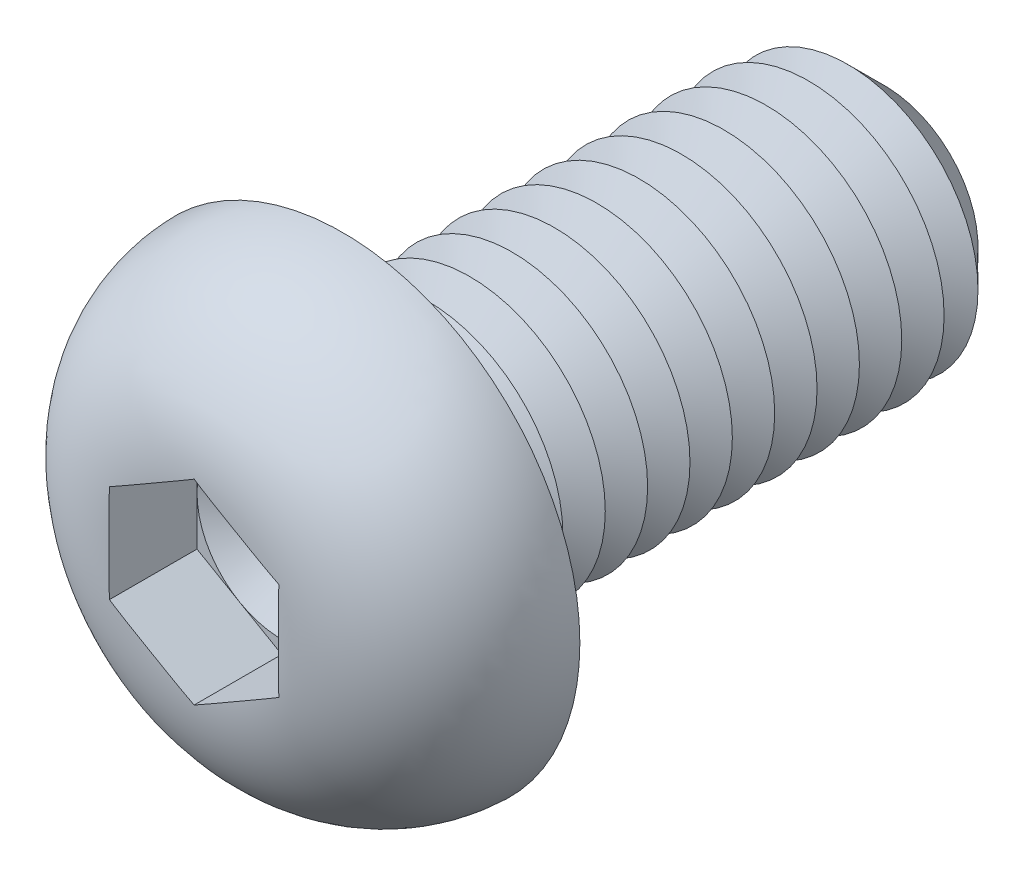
SolidWorks part; units mm, degrees
ref_plane "Front Plane" through (0, 0, 0) normal (0, 0, 1) x (1, 0, 0)
ref_plane "Top Plane" through (0, 0, 0) normal (0, 1, 0) x (1, 0, 0)
ref_plane "Right Plane" through (0, 0, 0) normal (1, 0, 0) x (0, 0, -1)
sketch "Sketch1" plane through (0, 0, 0) normal (1, 0, 0) x (0, 0, -1)
  line L0 (-47.9342, 0) -> (60.3146, 0) construction
sketch "Sketch2" plane through (0, 0, 0) normal (1, 0, 0) x (0, 0, -1)
  line L0 (0, 0) -> (-4.4, 0)
  line L1 (-47.9342, 0) -> (60.3146, 0) construction
  line L2 (-4.4, 0) -> (-4.4, 2.5011)
  line L3 (0, 7) -> (0, 0)
  arc A0 (-4.4, 2.5011) -> (0, 7) centre (0.1, 2.5011) cw
  dimension "D1" = 4.5
  dimension "D2" = 4.4
  dimension "D3" = 7
revolve "Revolve1" add sketch "Sketch2" angle 360 about L0
sketch "Sketch3" plane through (0, 0, 4.4) normal (0, 0, 1) x (1, 0, 0)
  line L1 (0, 2.8868) -> (-2.5, 1.4434)
  line L2 (-2.5, 1.4434) -> (-2.5, -1.4434)
  line L3 (-2.5, -1.4434) -> (0, -2.8868)
  line L4 (0, -2.8868) -> (2.5, -1.4434)
  line L5 (2.5, -1.4434) -> (2.5, 1.4434)
  line L6 (2.5, 1.4434) -> (0, 2.8868)
  circle A0 centre (0, 0) radius 2.5 construction
  dimension "D1" = 5
extrude "Cut-Extrude1" cut sketch "Sketch3" against normal blind 2.6
sketch "Sketch4" plane through (0, 0, 0) normal (0, 0, -1) x (-1, 0, 0)
  circle A0 centre (0, 0) radius 4
  dimension "D1" = 8
extrude "Boss-Extrude1" add sketch "Sketch4" along normal blind 16
chamfer "Chamfer1" distance 1.25 angle 45 1 edges at (-4, 0, -16)
sketch "Sketch5" plane through (0, 0, 0) normal (1, 0, 0) x (0, 0, -1)
  line L0 (1.25, 4) -> (2.5, 4)
  line L1 (14.75, 4) -> (0, 4) construction
  line L2 (2.5, 4) -> (1.875, 2.9175)
  line L3 (1.875, 2.9175) -> (1.25, 4)
  line L4 (0, -7) -> (0, 7) construction
  line L5 (14.75, 4) -> (0, 4) construction
  dimension "D1" = 1.25
  dimension "D2" = 1.25
revolve "Cut-Revolve1" cut sketch "Sketch5" angle 360 about L0
pattern_linear "LPattern1" count 11 spacing 1.25 along (0, 0, -1) of "Cut-Revolve1"
fillet "Fillet2" radius 0.5 1 edges at (4, 0, 0)
sketch "Sketch6" plane through (0, 0, 1.8) normal (0, 0, 1) x (1, 0, 0)
  line L0 (0, -2.8868) -> (2.5, -1.4434) construction
  circle A0 centre (0, 0) radius 2.5
extrude "Cut-Extrude2" cut sketch "Sketch6" against normal through all draft 60
